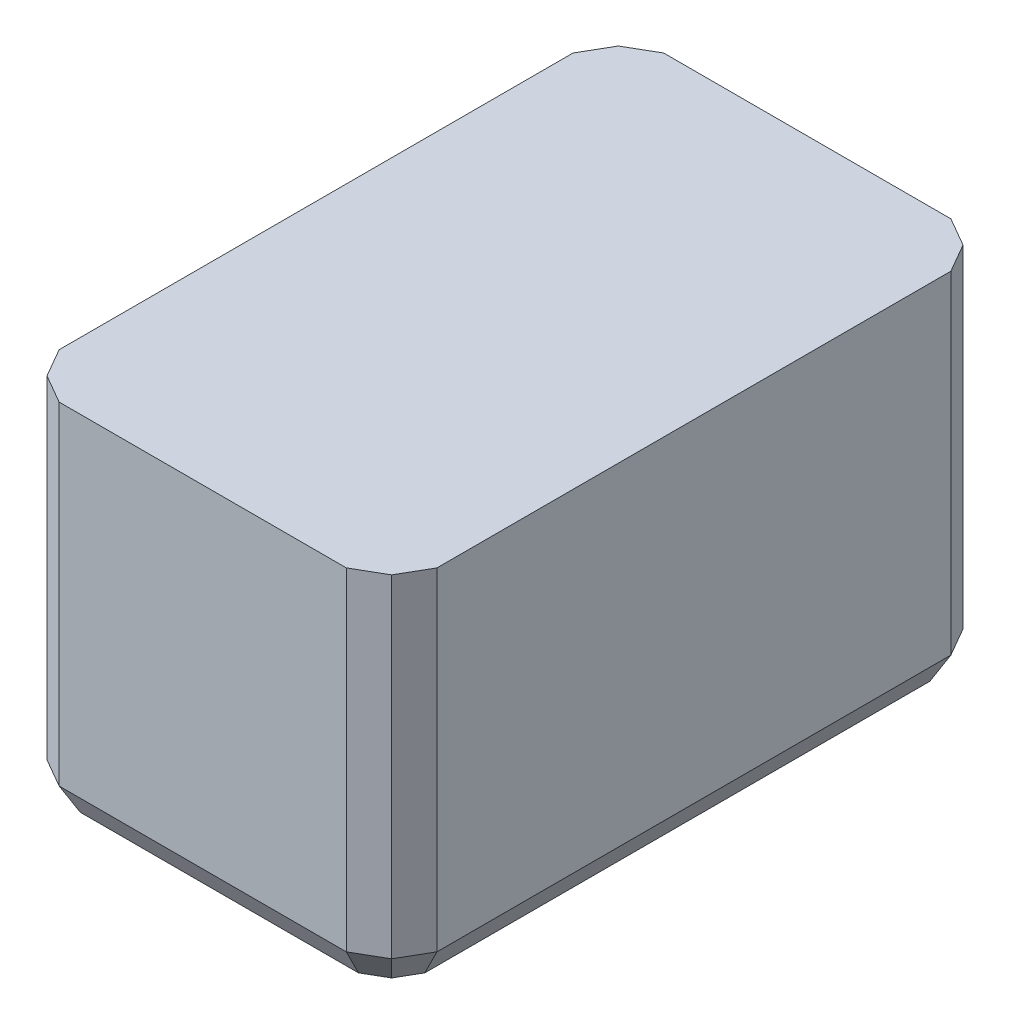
SolidWorks part; units mm, degrees
ref_plane "Ebene vorne" through (0, 0, 0) normal (0, 0, 1) x (1, 0, 0)
ref_plane "Ebene oben" through (0, 0, 0) normal (0, 1, 0) x (1, 0, 0)
ref_plane "Ebene rechts" through (0, 0, 0) normal (1, 0, 0) x (0, 0, -1)
sketch "Skizze1" plane through (0, 0, 0) normal (0, 1, 0) x (1, 0, 0)
  line L0 (-250, 340) -> (-250, -340)
  line L5 (-250, -340) -> (-228.0385, -378.0385)
  line L6 (-228.0385, -378.0385) -> (-190, -400)
  line L7 (-190, -400) -> (190, -400)
  line L8 (190, -400) -> (228.0385, -378.0385)
  line L9 (228.0385, -378.0385) -> (250, -340)
  line L10 (250, -340) -> (250, 340)
  line L11 (250, 340) -> (228.0385, 378.0385)
  line L12 (228.0385, 378.0385) -> (190, 400)
  line L13 (190, 400) -> (-190, 400)
  line L14 (-190, 400) -> (-228.0385, 378.0385)
  line L15 (-228.0385, 378.0385) -> (-250, 340)
  line L17 (250, 0) -> (-250, 0) construction
  line L18 (0, 400) -> (0, -400) construction
  point P22 (0, 0)
  dimension "D3" = 500
  dimension "A" = 60
  dimension "D4" = 800
  dimension "D5" = 150
extrude "Linear austragen1" add sketch "Skizze1" along normal blind 500
ref_plane "Ebene1" through (0, 0, -340) normal (0, 0, -1) x (-1, 0, 0)
sketch "Skizze2" plane through (0, 0, -340) normal (0, 0, -1) x (-1, 0, 0)
  line L0 (-250, 60) -> (-228.0385, 21.9615)
  line L1 (-250, 500) -> (-250, 0) construction
  line L2 (-228.0385, 21.9615) -> (-190, 0)
  line L3 (-190, 0) -> (190, 0) construction
  line L4 (-250, 60) -> (-250, 0)
  line L5 (-190, 0) -> (-250, 0)
  dimension "D1" = 150
  dimension "D2" = 150
sketch "Skizze3" plane through (0, 0, 0) normal (0, -1, 0) x (1, 0, 0)
  line L13 (-250, -340) -> (-228.0385, -378.0385)
  line L14 (-228.0385, -378.0385) -> (-190, -400)
  line L15 (-190, -400) -> (190, -400)
  line L16 (190, -400) -> (228.0385, -378.0385)
  line L17 (228.0385, -378.0385) -> (250, -340)
  line L18 (250, -340) -> (250, 340)
  line L19 (250, 340) -> (228.0385, 378.0385)
  line L20 (228.0385, 378.0385) -> (190, 400)
  line L21 (190, 400) -> (-190, 400)
  line L22 (-190, 400) -> (-228.0385, 378.0385)
  line L23 (-228.0385, 378.0385) -> (-250, 340)
  line L24 (-250, 340) -> (-250, -340)
  line L25 (-250, -340) -> (-228.0385, -378.0385)
  line L26 (-228.0385, -378.0385) -> (-190, -400)
  line L27 (-190, -400) -> (190, -400)
  line L28 (190, -400) -> (228.0385, -378.0385)
  line L29 (228.0385, -378.0385) -> (250, -340)
  line L30 (250, -340) -> (250, 340)
  line L31 (250, 340) -> (228.0385, 378.0385)
  line L32 (228.0385, 378.0385) -> (190, 400)
  line L33 (190, 400) -> (-190, 400)
  line L34 (-190, 400) -> (-228.0385, 378.0385)
  line L35 (-228.0385, 378.0385) -> (-250, 340)
  line L36 (-250, 340) -> (-250, -340)
  dimension "D1" = 0
sweep "Schnitt-Austragung2" cut profiles "Skizze2" path "Skizze3"
